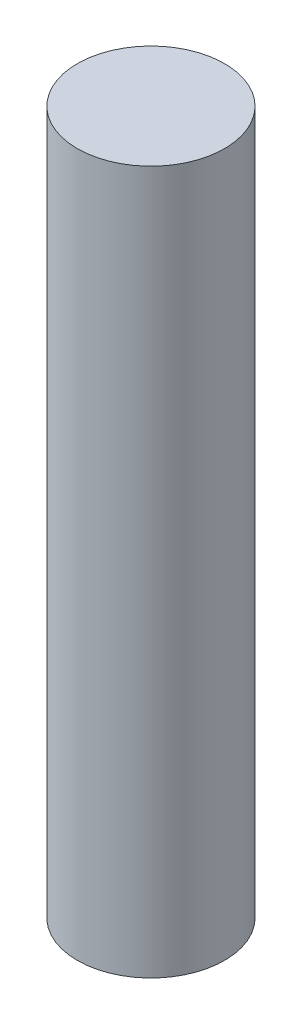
SolidWorks part; units mm, degrees
ref_plane "Front Plane" through (0, 0, 0) normal (0, 0, 1) x (1, 0, 0)
ref_plane "Top Plane" through (0, 0, 0) normal (0, 1, 0) x (1, 0, 0)
ref_plane "Right Plane" through (0, 0, 0) normal (1, 0, 0) x (0, 0, -1)
sketch "Sketch2" plane through (0, 0, 0) normal (0, 1, 0) x (1, 0, 0)
  circle A0 centre (0, 0) radius 0.995
  dimension "D1" = 1.99
extrude "Boss-Extrude1" add sketch "Sketch2" along normal blind 9.5
